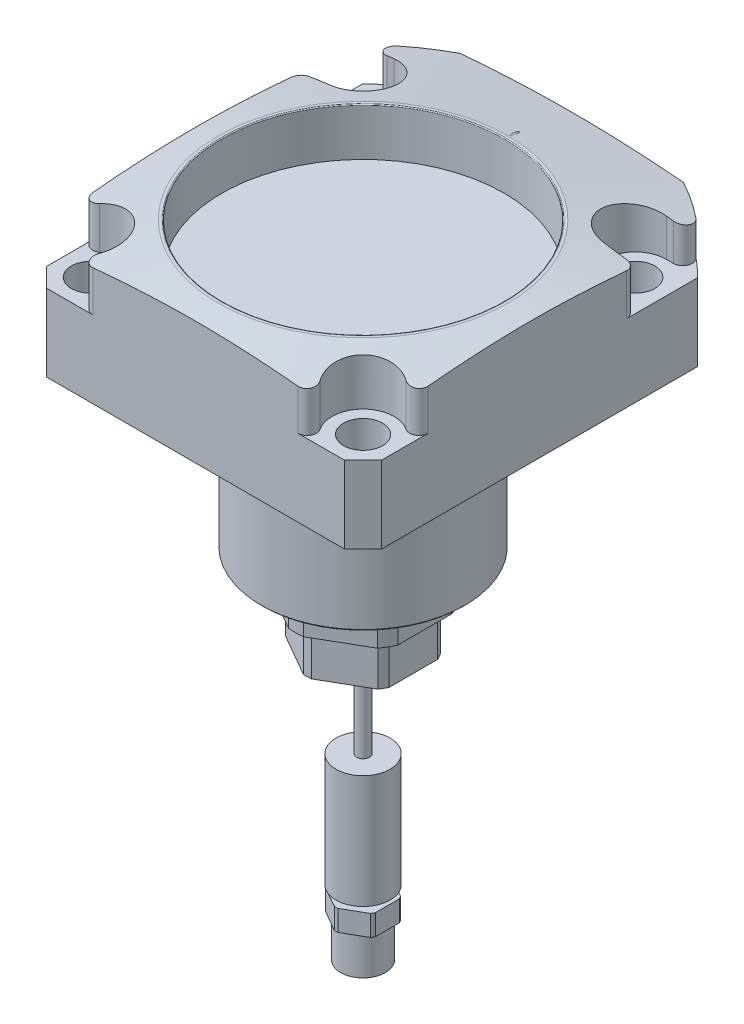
SolidWorks part; units mm, degrees
ref_plane "Front Plane" through (0, 0, 0) normal (0, 0, 1) x (1, 0, 0)
ref_plane "Top Plane" through (0, 0, 0) normal (0, 1, 0) x (1, 0, 0)
ref_plane "Right Plane" through (0, 0, 0) normal (1, 0, 0) x (0, 0, -1)
sketch "Sketch6" plane through (0, 0, 0) normal (0, 0, 1) x (1, 0, 0)
  line L0 (0, -8.9689) -> (0, 71.3762) construction
  line L1 (37.8968, 34.0614) -> (38.8747, 34.0614)
  line L2 (38.8747, 34.0614) -> (63.5, 29.7193)
  line L3 (63.5, 29.7193) -> (63.5, 0)
  line L4 (63.5, 0) -> (27.3812, 0)
  line L5 (27.3812, 0) -> (27.3812, -42.3926)
  line L6 (27.3812, -42.3926) -> (0, -42.3926)
  line L7 (0, -42.3926) -> (0, 21.2344)
  line L8 (37.8968, 34.0614) -> (37.8968, 21.2344)
  line L9 (37.8968, 21.2344) -> (0, 21.2344)
  dimension "D1" = 54.7624
  dimension "D2" = 34.0614
  dimension "D3" = 42.3926
  dimension "D4" = 127
  dimension "D5" = 10
  dimension "D6" = 77.7494
  dimension "D7" = 12.827
  dimension "D8" = 75.7936
  dimension "D9" = 76.454
revolve "Revolve3" add sketch "Sketch6" angle 360 about L0
fillet "Fillet7" radius 0.254 1 edges at (0, 34.0614, -37.8968)
sketch "Sketch7" plane through (0, 0, 0) normal (0, -1, 0) x (1, 0, 0)
  line L0 (0, 0) -> (0, -52.3237) construction
  line L1 (-39.9961, 45.0088) -> (39.9961, 45.0088)
  line L2 (-44.9961, 40.0088) -> (-44.9961, -55.9816)
  line L3 (-44.9961, -55.9816) -> (44.9961, -55.9816)
  line L4 (44.9961, 40.0088) -> (44.9961, -55.9816)
  line L5 (39.9961, 45.0088) -> (44.9961, 40.0088)
  line L6 (-44.9961, 40.0088) -> (-39.9961, 45.0088)
  point P0 (-44.9961, 45.0088)
  point P3 (44.9961, 45.0088)
  dimension "D1" = 89.9922
  dimension "D2" = 100.9904
  dimension "D3" = 45.0088
  dimension "D4" = 55.9816
  dimension "D5" = 44.9961
extrude "Cut-Extrude5" cut sketch "Sketch7" against normal through all flip side to cut
sketch "Sketch8" plane through (0, 0, 0) normal (0, -1, 0) x (1, 0, 0)
  circle A0 centre (-36.5252, 36.5252) radius 5.2451
  dimension "D1" = 10.4902
  dimension "D2" = 36.5252
  dimension "D3" = 36.5252
extrude "Cut-Extrude6" cut sketch "Sketch8" against normal through all
pattern_circular "CirPattern2" count 4 over 360 about axis through (0, 0, 0) along (0, 1, 0) of "Cut-Extrude6"
sketch "Sketch9" plane through (0, 34.0614, 0) normal (0, 1, 0) x (1, 0, 0)
  line L0 (-44.9961, -40.0088) -> (-39.9961, -45.0088) construction
  line L1 (-39.9961, -45.0088) -> (39.9961, -45.0088) construction
  line L2 (44.9961, 44.8564) -> (44.9961, 28.194)
  line L3 (-44.9961, -40.0088) -> (-39.9961, -45.0088)
  line L4 (44.9961, 28.194) -> (36.5252, 28.194)
  line L5 (36.5252, 44.8564) -> (44.9961, 44.8564)
  line L6 (-36.5252, 44.8564) -> (-44.9961, 44.8564)
  line L7 (-44.9961, 44.8063) -> (-44.9961, -40.0088) construction
  line L8 (-44.9961, 28.194) -> (-36.5252, 28.194)
  line L9 (-44.9961, 44.8564) -> (-44.9961, 28.194)
  line L10 (-39.9961, -45.0088) -> (-33.2267, -45.0088)
  line L11 (0, 0) -> (0, 26.6366) construction
  line L13 (-44.9961, -33.214) -> (-42.4162, -30.6342)
  line L14 (-30.6342, -42.4162) -> (-33.2267, -45.0088)
  line L15 (-44.9961, -33.214) -> (-44.9961, -40.0088)
  line L16 (44.9961, -33.214) -> (44.9961, -40.0088)
  line L17 (30.6342, -42.4162) -> (33.2267, -45.0088)
  line L18 (44.9961, -33.214) -> (42.4162, -30.6342)
  line L19 (39.9961, -45.0088) -> (33.2267, -45.0088)
  line L20 (44.9961, -40.0088) -> (39.9961, -45.0088)
  arc A0 (-30.6342, -42.4162) -> (-42.4162, -30.6342) centre (-36.5252, -36.5252) ccw
  arc A1 (-36.5252, 28.194) -> (-36.5252, 44.8564) centre (-36.5252, 36.5252) ccw
  arc A2 (30.6342, -42.4162) -> (42.4162, -30.6342) centre (36.5252, -36.5252) cw
  arc A3 (36.5252, 28.194) -> (36.5252, 44.8564) centre (36.5252, 36.5252) cw
  dimension "D1" = 16.6624
extrude "Cut-Extrude7" cut sketch "Sketch9" against normal offset from surface (13.4112 mm away) 20.6502
fillet "Fillet4" radius 2.4892 8 edges at (-44.9961, 26.1017, -28.194) (44.9961, 26.1017, -28.194) (44.9961, 25.8524, 33.214) (33.2267, 25.8509, 45.0088) (-33.2267, 25.8509, 45.0088) (-44.9961, 25.8524, 33.214) (44.9461, 25.1847, -44.8564) (-44.9461, 25.1847, -44.8564)
fillet "Fillet5" radius 0.4013 1 edges at (0, 0, -27.3812)
chamfer "Chamfer2" distance 0.5004 angle 45 1 edges at (0, -42.3926, -27.3812)
ref_plane "Plane1" through (0, 17.018, 0) normal (0, -1, 0) x (1, 0, 0)
sketch "Sketch11" plane through (0, 17.018, 0) normal (0, -1, 0) x (1, 0, 0)
  line L0 (-18, -4.7006) -> (-18, -58.3255) construction
  line L1 (-29.9718, -55.9816) -> (29.9718, -55.9816) construction
  line L2 (-24.1849, -55.7316) -> (-23.6396, -53.1662)
  line L3 (-23.6396, -53.1662) -> (-22.9784, -52.505)
  line L10 (-18, -55.9816) -> (-28.4775, -55.9816)
  line L11 (-18, -37.0116) -> (-18, -55.9816)
  line L12 (-22.9784, -37.0116) -> (-18, -37.0116)
  line L13 (-22.9784, -52.505) -> (-22.9784, -37.0116)
  line L15 (-28.4775, -55.7316) -> (-24.1849, -55.7316)
  line L16 (-28.4775, -55.9816) -> (-28.4775, -55.7316)
  dimension "D1" = 18
  dimension "D2" = 0.25
  dimension "D3" = 18.72
  dimension "D4" = 9.9568
  dimension "D5" = 20.955
  dimension "D6" = 12
  dimension "D7" = 12.3698
  dimension "D8" = 45
  dimension "D9" = 2.5654
revolve "Cut-Revolve5" cut sketch "Sketch11" angle 360 about L0
ref_plane "Plane2" through (0, 0, -46.7614) normal (0, 0, 1) x (1, 0, 0)
sketch "Sketch13" plane through (0, 0, -46.7614) normal (0, 0, 1) x (1, 0, 0)
  line L0 (-21.4544, 17.653) -> (-21.4544, 5.3993)
  line L1 (-22.572, 2.6416) -> (-22.1293, 4.7244)
  line L2 (-22.572, 2.6416) -> (-25.9375, 2.6416)
  line L3 (-25.9375, 2.6416) -> (-25.9375, 0)
  line L4 (-27.7825, 0) -> (27.7825, 0) construction
  line L5 (-25.9375, 0) -> (-18, 0)
  line L6 (-18, 0) -> (-18, 17.653)
  line L7 (-18, 17.653) -> (-21.4544, 17.653)
  line L8 (-18, 15.2099) -> (-18, -4.3918) construction
  line L9 (-22.1293, 4.7244) -> (-21.4544, 5.3993)
  dimension "D1" = 18
  dimension "D2" = 6.9088
  dimension "D3" = 15.0114
  dimension "D4" = 2.6416
  dimension "D5" = 15.875
  dimension "D6" = 45
  dimension "D7" = 2.0828
  dimension "D8" = 12
  dimension "D9" = 9.144
revolve "Cut-Revolve6" cut sketch "Sketch13" angle 360 about L8
mirror "Mirror4" about plane through (0, 0, 0) normal (1, 0, 0) of "Cut-Revolve5", "Cut-Revolve6"
sketch "Sketch16" plane through (0, 0, -46.7614) normal (0, 0, 1) x (1, 0, 0)
  line L0 (-22.572, 2.6416) -> (-13.428, 2.6416) construction
  line L1 (-18, 9.3219) -> (-18, -15.1063) construction
  line L2 (-18, 5.3993) -> (-18, 13.4331) construction
  line L3 (-22.572, 0.8763) -> (-22.572, -0.889) construction
  line L4 (-24.3373, -0.889) -> (-22.572, -0.889) construction
  circle A0 centre (-24.3373, 0.8763) radius 1.7653
revolve "Revolve7" add sketch "Sketch16" angle 360 about L1
mirror "Mirror3" about plane through (0, 0, 0) normal (1, 0, 0)
sketch "Sketch17" plane through (0, 0, 0) normal (1, 0, 0) x (0, 0, -1)
  line L0 (39.0485, 34.8025) -> (42.433, 34.2057) construction
  line L1 (55.9816, 31.045) -> (38.8747, 34.0614) construction
  line L2 (39.3671, 33.9746) -> (41.3367, 33.6273) construction
  line L3 (39.7451, 34.6797) -> (41.7147, 34.3324) construction
  line L5 (39.6062, 33.8918) -> (41.5758, 33.5445)
  line L6 (38.9572, 34.8186) -> (42.5025, 34.1934)
  arc A0 (38.9572, 34.8186) -> (39.6062, 33.8918) centre (39.7451, 34.6797) ccw
  arc A1 (41.5758, 33.5445) -> (42.5025, 34.1934) centre (41.7147, 34.3324) ccw
  dimension "D1" = 1.6
  dimension "D2" = 2
  dimension "D3" = 0.5
  dimension "D4" = 0.76
  dimension "D5" = 0.04
revolve "Cut-Revolve7" cut sketch "Sketch17" angle 360 about L6
sketch "Sketch35" plane through (5.4583, -42.3926, 0.4297) normal (0, -1, 0) x (1, 0, 0)
  circle A0 centre (-5.4583, -0.4297) radius 21.9202
  dimension "D1" = 43.8404
extrude "Boss-Extrude9" add sketch "Sketch35" along normal blind 2.8702
sketch "Sketch37" plane through (4.6382, -45.2628, 4.8157) normal (0, -1, 0) x (1, 0, 0)
  line L1 (-2.6345, -22.8403) -> (9.9697, -15.5633)
  line L2 (11.9734, -12.0927) -> (11.9734, 2.4613)
  line L3 (9.9697, 5.9318) -> (-2.6345, 13.2088)
  line L4 (-6.6419, 13.2088) -> (-19.2461, 5.9318)
  line L5 (-21.2498, 2.4613) -> (-21.2498, -12.0927)
  line L6 (-19.2461, -15.5633) -> (-6.6419, -22.8403)
  circle A0 centre (-4.6382, -4.8157) radius 16.6116 construction
  arc A1 (-2.6345, 13.2088) -> (-6.6419, 13.2088) centre (-4.6382, -4.8157) ccw
  arc A2 (-19.2461, 5.9318) -> (-21.2498, 2.4613) centre (-4.6382, -4.8157) ccw
  arc A3 (-21.2498, -12.0927) -> (-19.2461, -15.5633) centre (-4.6382, -4.8157) ccw
  arc A4 (-6.6419, -22.8403) -> (-2.6345, -22.8403) centre (-4.6382, -4.8157) ccw
  arc A5 (9.9697, -15.5633) -> (11.9734, -12.0927) centre (-4.6382, -4.8157) ccw
  arc A6 (11.9734, 2.4613) -> (9.9697, 5.9318) centre (-4.6382, -4.8157) ccw
  dimension "D2" = 36.2712
  dimension "D1" = 33.2232
extrude "Boss-Extrude10" add sketch "Sketch37" along normal blind 7.62
sketch "Sketch39" plane through (4.6382, -52.8828, 4.8157) normal (0, -1, 0) x (1, 0, 0)
  line L1 (8.8619, -11.3509) -> (8.8619, 1.7194)
  line L2 (7.7714, 3.6081) -> (-3.5478, 10.1433)
  line L3 (-5.7287, 10.1433) -> (-17.0479, 3.6081)
  line L4 (-18.1383, 1.7194) -> (-18.1383, -11.3509)
  line L5 (-17.0479, -13.2396) -> (-5.7287, -19.7747)
  line L6 (-3.5478, -19.7747) -> (7.7714, -13.2396)
  circle A0 centre (-4.6382, -4.8157) radius 13.5001 construction
  arc A1 (-3.5478, 10.1433) -> (-5.7287, 10.1433) centre (-4.6382, -4.8157) ccw
  arc A2 (8.8619, 1.7194) -> (7.7714, 3.6081) centre (-4.6382, -4.8157) ccw
  arc A3 (7.7714, -13.2396) -> (8.8619, -11.3509) centre (-4.6382, -4.8157) ccw
  arc A4 (-5.7287, -19.7747) -> (-3.5478, -19.7747) centre (-4.6382, -4.8157) ccw
  arc A5 (-18.1383, -11.3509) -> (-17.0479, -13.2396) centre (-4.6382, -4.8157) ccw
  arc A6 (-17.0479, 3.6081) -> (-18.1383, 1.7194) centre (-4.6382, -4.8157) ccw
  dimension "D2" = 29.9974
  dimension "D1" = 27.0002
extrude "Boss-Extrude11" add sketch "Sketch39" along normal blind 11.7856
sketch "Sketch41" plane through (4.6382, -64.6684, 4.8157) normal (0, -1, 0) x (1, 0, 0)
  circle A0 centre (-4.6382, -4.8157) radius 1.7018
  dimension "D1" = 3.4036
extrude "Boss-Extrude12" add sketch "Sketch41" along normal blind 25.4
sketch "Sketch43" plane through (4.6382, -90.0684, 4.8157) normal (0, -1, 0) x (1, 0, 0)
  circle A0 centre (-4.6382, -4.8157) radius 7.2517
  dimension "D1" = 14.5034
extrude "Boss-Extrude13" add sketch "Sketch43" along normal blind 30.4038
sketch "Sketch45" plane through (4.6382, -120.4722, 4.8157) normal (0, -1, 0) x (1, 0, 0)
  circle A0 centre (-4.6382, -4.8157) radius 4.2545
  dimension "D1" = 8.509
extrude "Boss-Extrude14" add sketch "Sketch45" along normal blind 1.7018
sketch "Sketch47" plane through (4.6382, -122.174, 4.8157) normal (0, -1, 0) x (1, 0, 0)
  line L1 (-11.1406, -1.6054) -> (-11.1406, -8.026)
  line L2 (-10.6696, -8.8418) -> (-5.1092, -12.0521)
  line L3 (-4.1672, -12.0521) -> (1.3932, -8.8418)
  line L4 (1.8642, -8.026) -> (1.8642, -1.6054)
  line L5 (1.3932, -0.7896) -> (-4.1672, 2.4207)
  line L6 (-5.1092, 2.4207) -> (-10.6696, -0.7896)
  circle A0 centre (-4.6382, -4.8157) radius 6.5024 construction
  arc A1 (-11.1406, -8.026) -> (-10.6696, -8.8418) centre (-4.6382, -4.8157) ccw
  arc A2 (-10.6696, -0.7896) -> (-11.1406, -1.6054) centre (-4.6382, -4.8157) ccw
  arc A3 (-4.1672, 2.4207) -> (-5.1092, 2.4207) centre (-4.6382, -4.8157) ccw
  arc A4 (1.8642, -1.6054) -> (1.3932, -0.7896) centre (-4.6382, -4.8157) ccw
  arc A5 (1.3932, -8.8418) -> (1.8642, -8.026) centre (-4.6382, -4.8157) ccw
  arc A6 (-5.1092, -12.0521) -> (-4.1672, -12.0521) centre (-4.6382, -4.8157) ccw
  dimension "D2" = 14.5034
  dimension "D1" = 13.0048
extrude "Boss-Extrude15" add sketch "Sketch47" along normal blind 5.588
sketch "Sketch49" plane through (4.6382, -127.762, 4.8157) normal (0, -1, 0) x (1, 0, 0)
  circle A0 centre (-4.6382, -4.8157) radius 5.9944
  dimension "D1" = 11.9888
extrude "Boss-Extrude16" add sketch "Sketch49" along normal blind 10.2108
equation "\"D3@Sketch16\"=\"D1@Sketch16\"/2"
